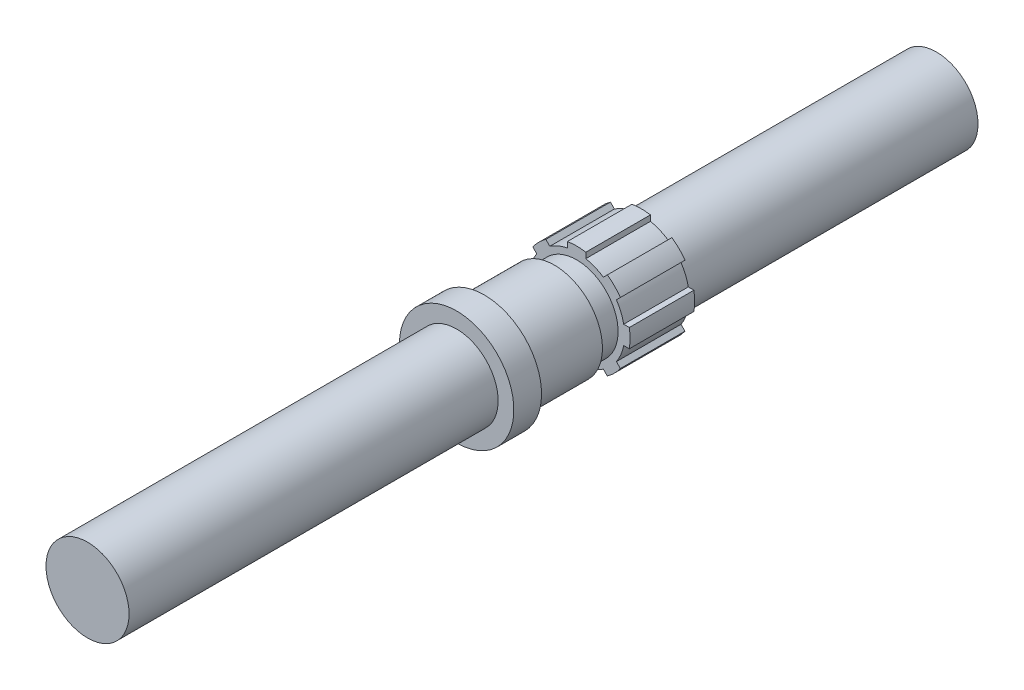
SolidWorks part; units mm, degrees
ref_plane "Vorne" through (0, 0, 0) normal (0, 0, 1) x (1, 0, 0)
ref_plane "Oben" through (0, 0, 0) normal (0, 1, 0) x (1, 0, 0)
ref_plane "Rechts" through (0, 0, 0) normal (1, 0, 0) x (0, 0, -1)
sketch "Skizze1" plane through (0, 0, 0) normal (0, 0, 1) x (1, 0, 0)
  circle A0 centre (0, 0) radius 22.5
  dimension "D1" = 45
extrude "Basis-Linear austragen" add sketch "Skizze1" along normal blind 460
ref_plane "Ebene1" through (0, 0, 160) normal (0, 0, -1) x (-1, 0, 0)
sketch "Skizze2" plane through (0, 0, 160) normal (0, 0, -1) x (-1, 0, 0)
  circle A0 centre (0, 0) radius 26
  dimension "D1" = 52
extrude "Aufsatz-Linear austragen1" add sketch "Skizze2" against normal blind 85
sketch "Skizze4" plane through (0, 0, 160) normal (0, 0, -1) x (-1, 0, 0)
  line L0 (0, 0) -> (0, 34.8579) construction
  line L2 (-5, 25.5147) -> (-5, 28.5657)
  line L4 (5, 25.5147) -> (5, 28.5657)
  arc A0 (5, 28.5657) -> (-5, 28.5657) centre (0, 0) ccw
  circle A1 centre (0, 0) radius 26 construction
  arc A2 (5, 25.5147) -> (-5, 25.5147) centre (0, 0) ccw
  dimension "D1" = 58
  dimension "D2" = 10
extrude "Linear austragen1" add sketch "Skizze4" against normal blind 35
pattern_circular "Kreismuster1" count 8 over 360 about axis through (0, 0, 0) along (0, 0, 1) of "Linear austragen1"
sketch "Skizze3" plane through (0, 0, 245) normal (0, 0, -1) x (-1, 0, 0)
  circle A0 centre (0, 0) radius 31
  dimension "D1" = 62
extrude "Aufsatz-Linear austragen2" add sketch "Skizze3" against normal blind 15
sketch "Skizze5" plane through (0, 0, 0) normal (1, 0, 0) x (0, 0, -1)
  line L1 (-207, 26) -> (-195, 26)
  line L2 (-207, 26) -> (-207, 22.5)
  line L3 (-207, 22.5) -> (-195, 22.5)
  line L4 (-195, 26) -> (-195, 22.5)
  line L5 (-195, 28.5657) -> (-195, 25.5147) construction
  line L6 (0, 0) -> (-202.246, 0) construction
  line L7 (-195, 26) -> (-245, 26) construction
  dimension "D1" = 12
  dimension "D2" = 45
revolve "Schnitt-Rotation1" cut sketch "Skizze5" angle 360 about L6
